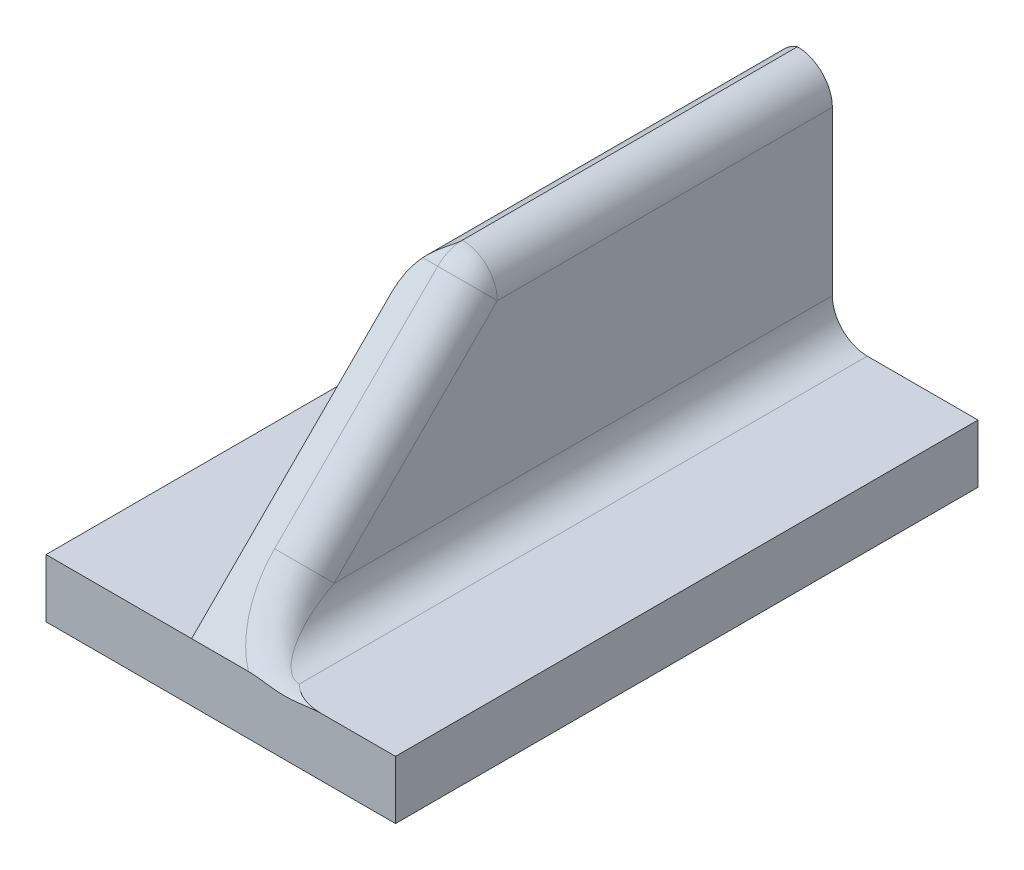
SolidWorks part; units mm, degrees
ref_plane "Front Plane" through (0, 0, 0) normal (0, 0, 1) x (1, 0, 0)
ref_plane "Top Plane" through (0, 0, 0) normal (0, 1, 0) x (1, 0, 0)
ref_plane "Right Plane" through (0, 0, 0) normal (1, 0, 0) x (0, 0, -1)
sketch "Sketch1" plane through (0, 0, 0) normal (0, 1, 0) x (1, 0, 0)
  line L1 (-15, 50) -> (15, 50)
  line L2 (-15, 50) -> (-15, 0)
  line L3 (-15, 0) -> (15, 0)
  line L4 (15, 50) -> (15, 0)
  dimension "D1" = 50
  dimension "D2" = 30
extrude "Extrude1" add sketch "Sketch1" along normal blind 5
sketch "Sketch3" plane through (0, 0, 0) normal (1, 0, 0) x (0, 0, -1)
  line L0 (0, 5) -> (20, 25)
  line L1 (20, 25) -> (50, 25)
  line L2 (50, 25) -> (50, 5)
  line L3 (50, 5) -> (0, 5)
  dimension "D1" = 45
  dimension "D2" = 20
extrude "Extrude2" add sketch "Sketch3" along normal mid plane 5
fillet "Fillet1" radius 3 1 edges
fillet "Fillet2" radius 3 4 edges at (3.3787, 5.8787, -0.8787) (2.5, 25, -35) (0, 25, -20)
fillet "Fillet3" radius 3 2 edges at (-2.5, 25, -35.6213)
